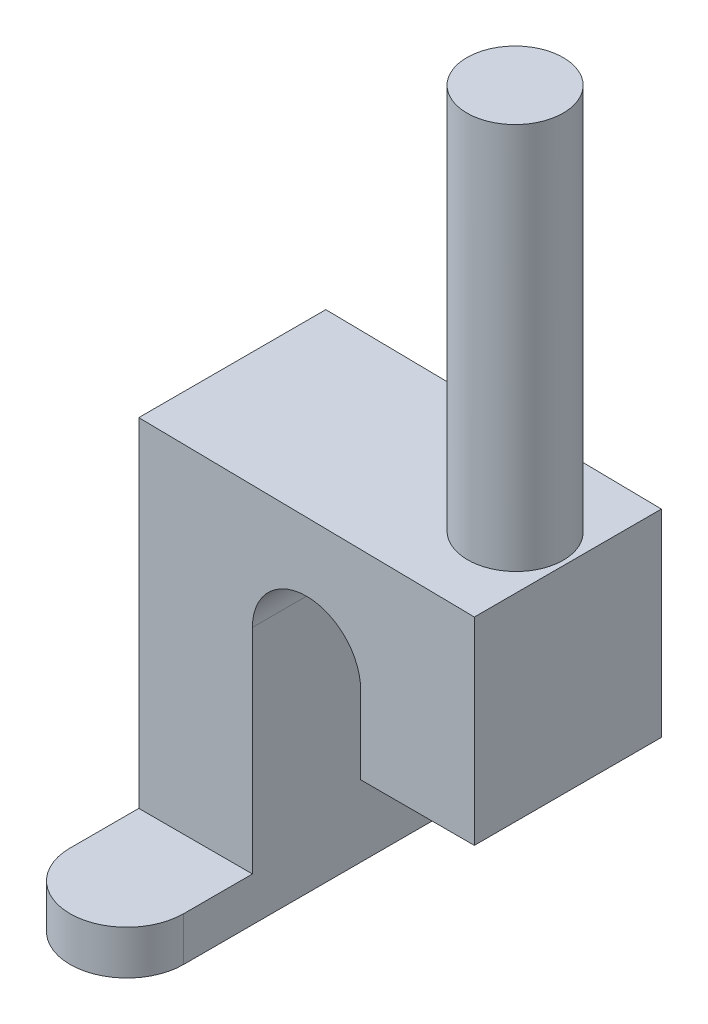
SolidWorks part; units mm, degrees
ref_plane "Front Plane" through (0, 0, 0) normal (0, 0, 1) x (1, 0, 0)
ref_plane "Top Plane" through (0, 0, 0) normal (0, 1, 0) x (1, 0, 0)
ref_plane "Right Plane" through (0, 0, 0) normal (1, 0, 0) x (0, 0, -1)
sketch "Sketch1" plane through (0, 0, 0) normal (0, 0, 1) x (1, 0, 0)
  line L2 (7.747, -3.593) -> (2.5, -3.593)
  line L3 (7.747, -3.593) -> (7.747, 23.425)
  line L4 (7.747, 23.425) -> (2.8737, 23.425)
  line L9 (-2.5, 0) -> (-2.5, -11.8905)
  line L10 (2.8737, 5.6117) -> (-7.747, 5.7672)
  line L11 (2.8737, 23.425) -> (2.8737, 5.6117)
  line L12 (-7.747, -11.8905) -> (-2.5, -11.8905)
  line L13 (-7.747, 5.7672) -> (-7.747, -11.8905)
  line L14 (2.5, 0) -> (2.5, -3.593)
  arc A1 (-2.5, 0) -> (2.5, 0) centre (0, 0) cw
extrude "Boss-Extrude1" add sketch "Sketch1" along normal mid plane 8.636
ref_plane "Plane1" through (0, 23.425, 0) normal (0, 1, 0) x (1, 0, 0)
sketch "Sketch2" plane through (0, 23.425, 0) normal (0, 1, 0) x (1, 0, 0)
  line L0 (7.747, 0) -> (-7.747, 0) construction
  line L1 (7.747, -4.318) -> (7.747, 4.318) construction
  line L2 (-7.747, -4.318) -> (-7.747, 4.318) construction
  line L5 (1.3171, 5.6364) -> (9.8589, 5.6364)
  line L6 (1.3171, 5.6364) -> (1.3171, -5.4427)
  line L7 (1.3171, -5.4427) -> (9.8589, -5.4427)
  line L8 (9.8589, 5.6364) -> (9.8589, -5.4427)
  circle A0 centre (5.3104, 0) radius 2.2225
  dimension "D1" = 4.445
  dimension "D2" = 2.4366
extrude "Cut-Extrude1" cut sketch "Sketch2" against normal up to surface (17.849 mm away)
ref_plane "Plane2" through (0, 0, 4.318) normal (0, 0, 1) x (1, 0, 0)
sketch "Sketch3" plane through (0, 0, 4.318) normal (0, 0, 1) x (1, 0, 0)
  line L0 (-2.5, -11.8905) -> (-2.5, 0) construction
  line L1 (-7.747, -11.8905) -> (-2.5, -11.8905)
  line L2 (-7.747, -11.8905) -> (-7.747, -9.8585)
  line L3 (-7.747, -9.8585) -> (-2.5, -9.8585)
  line L4 (-2.5, -11.8905) -> (-2.5, -9.8585)
  dimension "D1" = 2.032
extrude "Boss-Extrude2" add sketch "Sketch3" along normal blind 6.35
sketch "Sketch4" plane through (0, 0, 0) normal (0, 1, 0) x (1, 0, 0)
  line L0 (-7.747, -10.668) -> (-7.747, -4.318) construction
  line L1 (-2.5, -10.668) -> (-2.5, -4.318) construction
  line L2 (-7.747, -7.493) -> (-9.5522, -7.493)
  line L3 (-9.5522, -7.493) -> (-9.5522, -11.5392)
  line L4 (-9.5522, -11.5392) -> (-1.0668, -11.5392)
  line L5 (-1.0668, -11.5392) -> (-1.0668, -7.493)
  line L6 (-1.0668, -7.493) -> (-2.5, -7.493)
  arc A0 (-7.747, -7.493) -> (-2.5, -7.493) centre (-5.1235, -7.493) ccw
extrude "Cut-Extrude2" cut sketch "Sketch4" against normal through all
